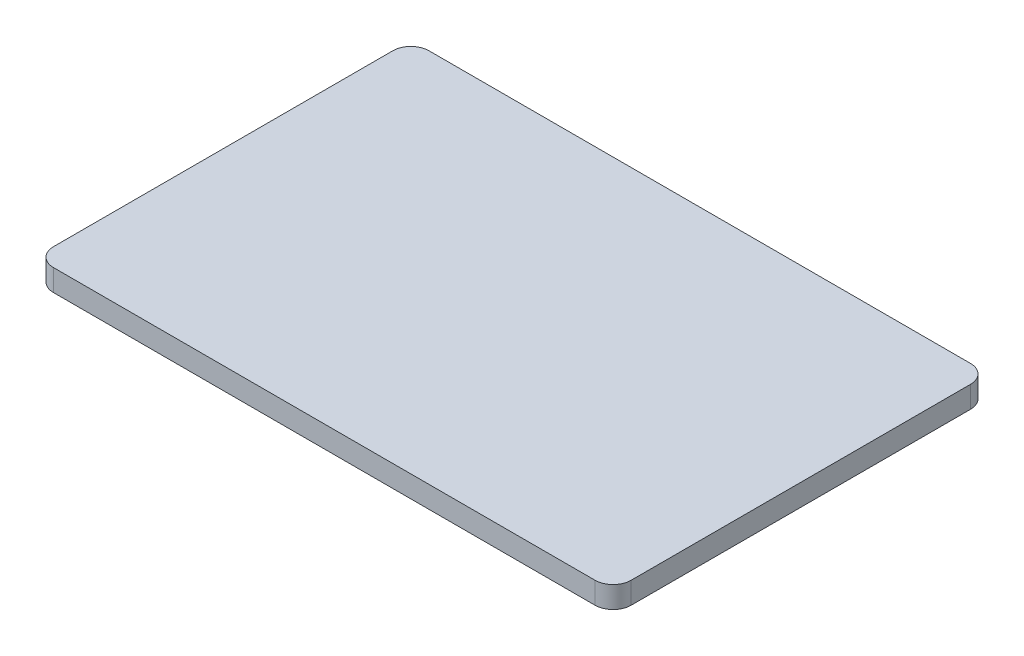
SolidWorks part; units mm, degrees
ref_plane "Front Plane" through (0, 0, 0) normal (0, 0, 1) x (1, 0, 0)
ref_plane "Top Plane" through (0, 0, 0) normal (0, 1, 0) x (1, 0, 0)
ref_plane "Right Plane" through (0, 0, 0) normal (1, 0, 0) x (0, 0, -1)
sketch "Sketch1" plane through (0, 0, 0) normal (0, 1, 0) x (1, 0, 0)
  line L1 (-37.5, -26) -> (37.5, -26)
  line L2 (-40, -23.5) -> (-40, 23.5)
  line L3 (-37.5, 26) -> (37.5, 26)
  line L4 (40, -23.5) -> (40, 23.5)
  line L5 (-40, -26) -> (40, 26) construction
  line L6 (-40, 26) -> (40, -26) construction
  arc A0 (-40, -23.5) -> (-37.5, -26) centre (-37.5, -23.5) ccw
  arc A1 (37.5, -26) -> (40, -23.5) centre (37.5, -23.5) ccw
  arc A2 (40, 23.5) -> (37.5, 26) centre (37.5, 23.5) ccw
  arc A3 (-37.5, 26) -> (-40, 23.5) centre (-37.5, 23.5) ccw
  point P0 (0, 0)
  dimension "D3" = 2.5
  dimension "D1" = 52
  dimension "D2" = 80
extrude "Boss-Extrude1" add sketch "Sketch1" along normal blind 3
